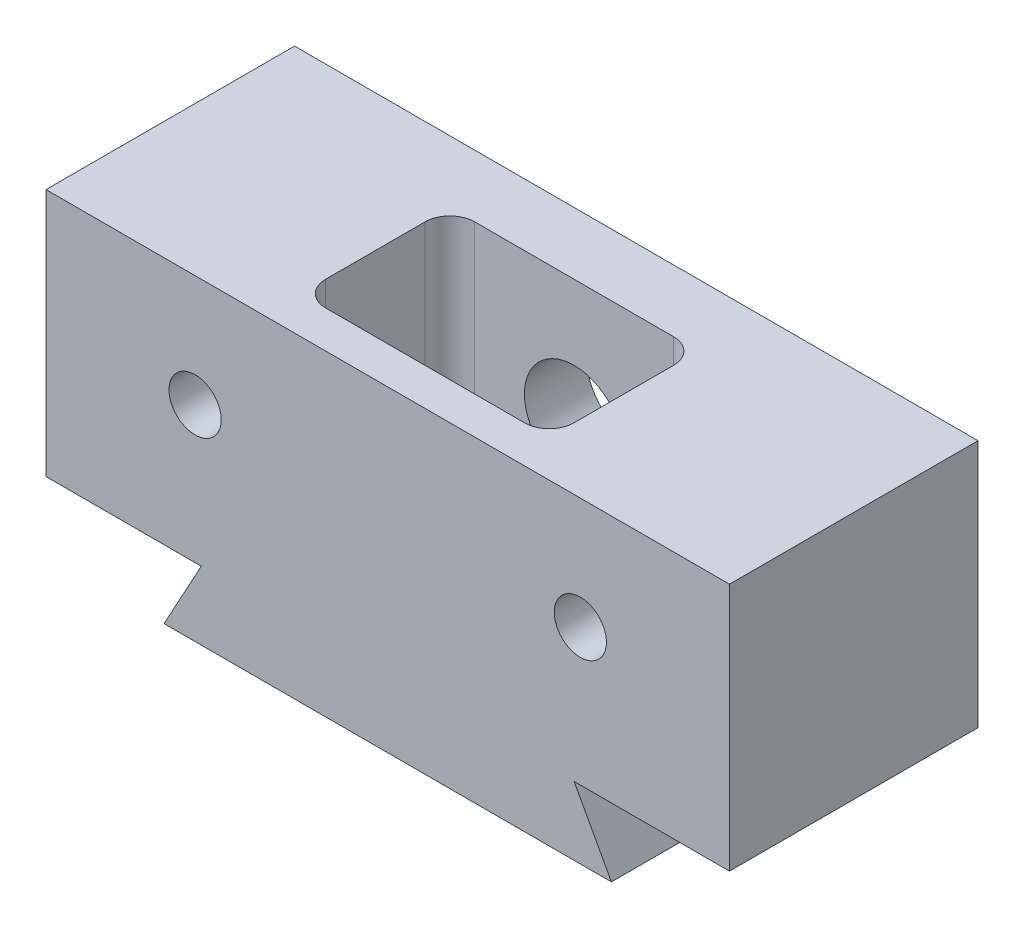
SolidWorks part; units mm, degrees
ref_plane "Front Plane" through (0, 0, 0) normal (0, 0, 1) x (1, 0, 0)
ref_plane "Top Plane" through (0, 0, 0) normal (0, 1, 0) x (1, 0, 0)
ref_plane "Right Plane" through (0, 0, 0) normal (1, 0, 0) x (0, 0, -1)
sketch "Sketch1" plane through (0, 0, 0) normal (0, 0, 1) x (1, 0, 0)
  line L0 (12.5, 0) -> (9.5, -5.5)
  line L1 (0, 0) -> (12.5, 0)
  line L2 (0, 0) -> (0, 20)
  line L3 (0, 20) -> (55, 20)
  line L4 (55, 0) -> (55, 20)
  line L5 (9.5, -5.5) -> (45.5, -5.5)
  line L6 (45.5, -5.5) -> (42.5, 0)
  line L7 (42.5, 0) -> (55, 0)
  dimension "D1" = 55
  dimension "D2" = 20
  dimension "D3" = 5.5
  dimension "D4" = 12.5
  dimension "D5" = 9.5
  dimension "D6" = 12.5
  dimension "D7" = 9.5
extrude "Boss-Extrude1" add sketch "Sketch1" along normal blind 20
sketch "Sketch2" plane through (0, 20, 0) normal (0, 1, 0) x (1, 0, 0)
  line L0 (0, -20) -> (0, 0) construction
  line L1 (19.5, -5) -> (35.5, -5)
  line L2 (17.5, -7) -> (17.5, -15)
  line L3 (19.5, -17) -> (35.5, -17)
  line L4 (37.5, -7) -> (37.5, -15)
  line L5 (55, 0) -> (0, 0) construction
  arc A0 (17.5, -15) -> (19.5, -17) centre (19.5, -15) ccw
  arc A1 (35.5, -17) -> (37.5, -15) centre (35.5, -15) ccw
  arc A2 (35.5, -5) -> (37.5, -7) centre (35.5, -7) cw
  arc A3 (19.5, -5) -> (17.5, -7) centre (19.5, -7) ccw
  point P12 (37.5, -17)
  point P15 (37.5, -5)
  point P18 (17.5, -5)
  dimension "D5" = 2
  dimension "D1" = 17.5
  dimension "D2" = 20
  dimension "D3" = 12
  dimension "D4" = 5
extrude "Cut-Extrude1" cut sketch "Sketch2" against normal blind 16
sketch "Sketch3" plane through (0, 0, 0) normal (0, 0, -1) x (-1, 0, 0)
  line L0 (-55, 20) -> (0, 20) construction
  line L1 (-55, 0) -> (-55, 20) construction
  circle A0 centre (-27.5, 10) radius 4
  dimension "D1" = 8
  dimension "D2" = 10
  dimension "D3" = 27.5
extrude "Cut-Extrude2" cut sketch "Sketch3" against normal up to surface (5 mm away)
sketch "Sketch4" plane through (0, 0, 20) normal (0, 0, 1) x (1, 0, 0)
  line L0 (0, 20) -> (0, 0) construction
  line L1 (55, 20) -> (0, 20) construction
  line L2 (55, 0) -> (55, 20) construction
  point P0 (12, 11)
  point P1 (43, 11)
  dimension "D1" = 12
  dimension "D2" = 9
  dimension "D3" = 9
  dimension "D4" = 12
hole_wizard "M5x0.8 Tapped Hole1" positions "3DSketch1" profile "Sketch5" tap size "M5x0.8" standard "ANSI Metric"
sketch3d "3DSketch1"
  point P0 (12, 11, 20)
  point P3 (43, 11, 20)
sketch "Sketch5" plane through (12, 11, 20) normal (1, 0, 0) x (0, -1, 0)
  line L0 (0, 0) -> (0, 11.2618)
  line L1 (0, 11.2618) -> (2.1, 10)
  line L2 (2.1, 10) -> (2.1, 0)
  line L5 (2.1, 0) -> (0, 0)
  line L10 (0, 11.2618) -> (-2.1, 10) construction
  line L11 (0, -6.35) -> (0, 107.95) construction
  dimension "Tap Drill Dia." = 4.2
  dimension "Tap Drill Depth" = 10
  dimension "Drill Angle" = 118
